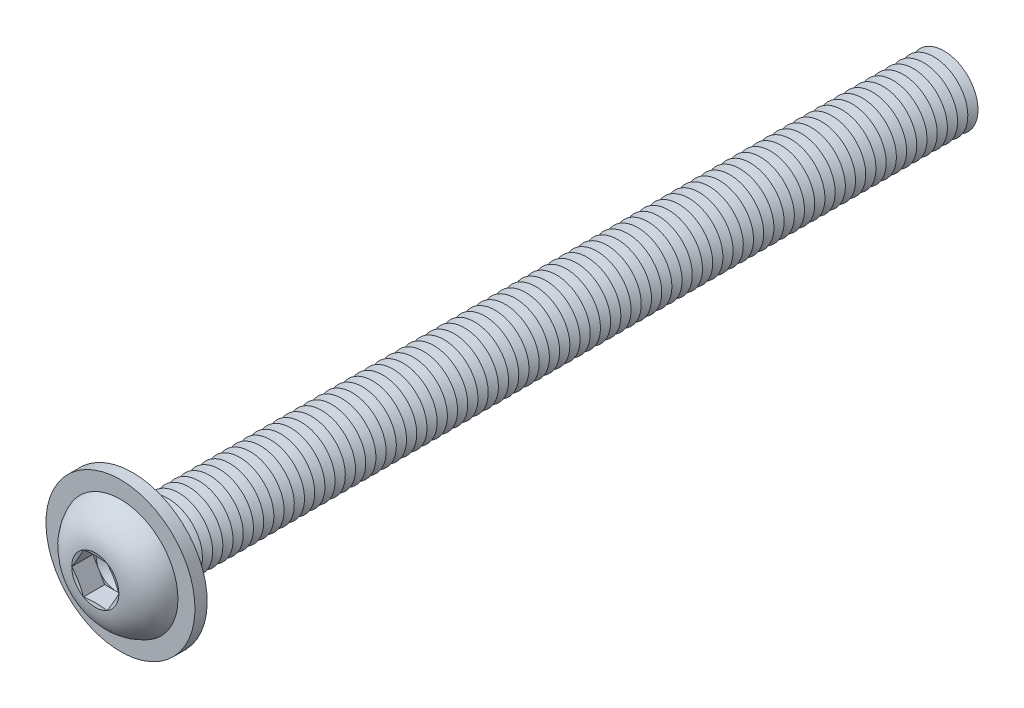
SolidWorks part; units mm, degrees
ref_plane "Front Plane" through (0, 0, 0) normal (0, 0, 1) x (1, 0, 0)
ref_plane "Top Plane" through (0, 0, 0) normal (0, 1, 0) x (1, 0, 0)
ref_plane "Right Plane" through (0, 0, 0) normal (1, 0, 0) x (0, 0, -1)
sketch "Sketch1" plane through (0, 0, 0) normal (1, 0, 0) x (0, 0, -1)
  line L0 (0, 5) -> (0, 8.75)
  line L3 (0, 5) -> (120, 5)
  line L4 (120, 5) -> (120, 0)
  line L5 (120, 0) -> (-5.5, 0) construction
  line L6 (-5.5, 0) -> (120, 0)
  line L7 (-5.5, 3.4641) -> (-5.5, 1.732) construction
  line L8 (-5.5, 1.732) -> (-5.5, 0)
  line L9 (-5.5, 3.4641) -> (-5.0359, 1.732)
  line L10 (-5.0359, 1.732) -> (-5.5, 1.732)
  line L11 (120, 0) -> (22.7481, 0) construction
  line L12 (0, 8.75) -> (-5.5, 8.75) construction
  arc A1 (0, 8.75) -> (-5.5, 3.4641) centre (0, 3.2457) ccw
  point P8 (120, 2.5)
  dimension "D1" = 17.5
  dimension "D2" = 10
  dimension "D3" = 5.5
  dimension "D4" = 6.9282
  dimension "D5" = 120
  dimension "D6" = 15
revolve "Revolve1" add sketch "Sketch1" angle 360 about L5
fillet "Fillet1" radius 0.75 1 edges at (0, 5, 0)
sketch "Sketch2" plane through (0, 0, 0) normal (1, 0, 0) x (0, 0, -1)
  line L0 (119.25, 5) -> (120.75, 5)
  line L1 (120, 5) -> (0.75, 5) construction
  line L2 (120.75, 5) -> (120, 3.701)
  line L3 (120, -5) -> (120, 5) construction
  line L4 (120, 3.701) -> (119.25, 5)
  dimension "D1" = 1.5
revolve "Cut-Revolve1" cut sketch "Sketch2" angle 360 about axis through (0, 0, -120) along (0, 0, -1)
pattern_linear "LPattern1" count 80 spacing 1.5 along (0, 0, 1) of "Cut-Revolve1"
sketch "Sketch3" plane through (0, 0, 5.5) normal (0, 0, 1) x (1, 0, 0)
  line L7 (1.732, 3) -> (-1.7321, 3)
  line L8 (-1.7321, 3) -> (-3.4641, 0)
  line L9 (-3.4641, 0) -> (-1.732, -3)
  line L10 (-1.732, -3) -> (1.732, -3)
  line L11 (1.732, -3) -> (3.4641, 0)
  line L12 (3.4641, 0) -> (1.732, 3)
  circle A0 centre (0, 0) radius 3 construction
  circle A3 centre (0, 0) radius 3.4641 construction
extrude "Cut-Extrude1" cut sketch "Sketch3" against normal blind 3.12
sketch "Sketch4" plane through (0, 0, 2.38) normal (0, 0, 1) x (1, 0, 0)
  line L1 (1.732, 3) -> (-1.7321, 3) construction
  circle A0 centre (0, 0) radius 3
extrude "Cut-Extrude2" cut sketch "Sketch4" against normal through all draft 60
sketch "Sketch5" plane through (0, 0, 0) normal (0, 0, -1) x (-1, 0, 0)
  circle A0 centre (0, 0) radius 10.95
  circle A1 centre (0, 0) radius 5.75
  circle A2 centre (0, 0) radius 5.75 construction
  dimension "D1" = 21.9
extrude "Boss-Extrude1" add sketch "Sketch5" against normal blind 1.8
